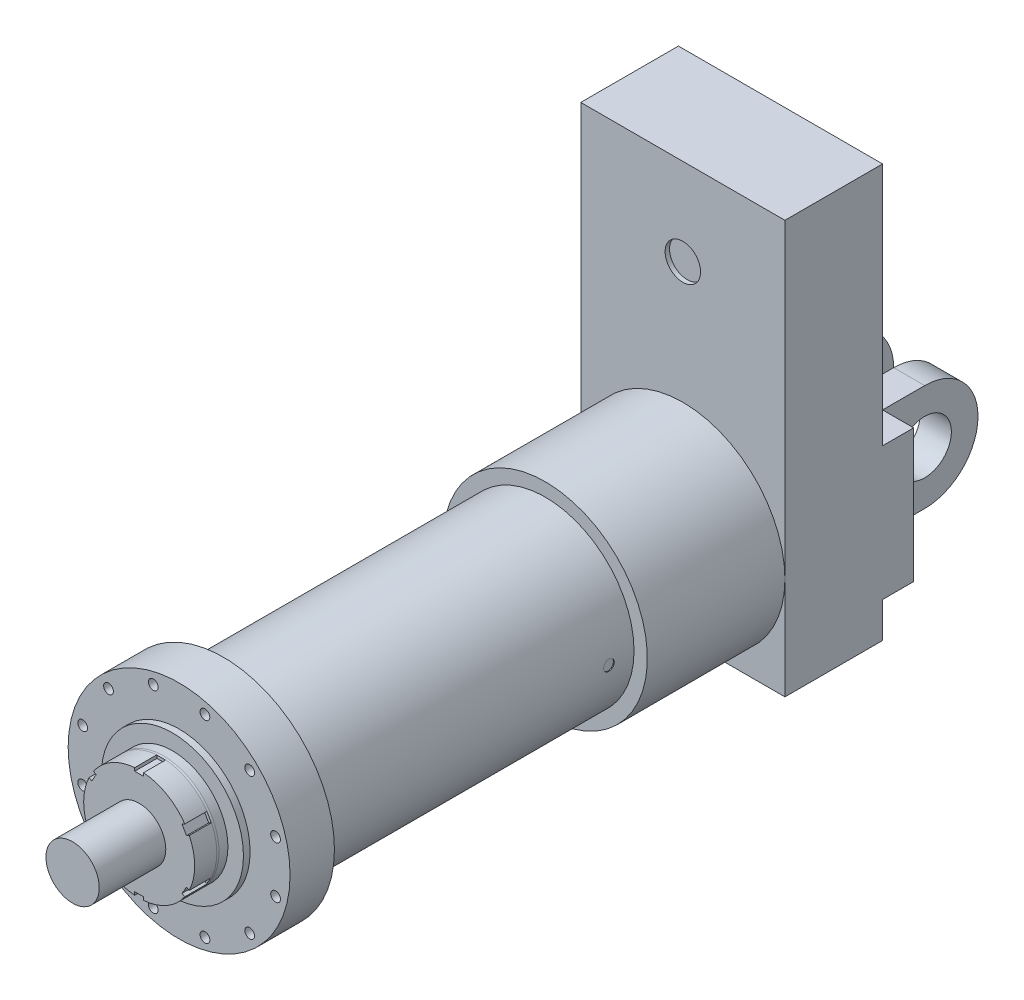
SolidWorks part; units mm, degrees
ref_plane "前视基准面" through (0, 0, 0) normal (0, 0, 1) x (1, 0, 0)
ref_plane "上视基准面" through (0, 0, 0) normal (0, 1, 0) x (1, 0, 0)
ref_plane "右视基准面" through (0, 0, 0) normal (1, 0, 0) x (0, 0, -1)
sketch "草图1" plane through (0, 0, 0) normal (0, 0, 1) x (1, 0, 0)
  circle A0 centre (0, 0) radius 200
  dimension "D1" = 400
extrude "凸台-拉伸1" add sketch "草图1" along normal blind 725
sketch "草图2" plane through (0, 0, 725) normal (0, 0, 1) x (1, 0, 0)
  line L0 (0, 0) -> (351.3656, 0) construction
  line L1 (0, 0) -> (299.4379, 80.2342) construction
  circle A0 centre (0, 0) radius 250
  circle A1 centre (0, 0) radius 225 construction
  circle A2 centre (217.3333, 58.2343) radius 11
  circle A3 centre (217.3333, -58.2343) radius 11
  circle A4 centre (159.099, -159.099) radius 11
  circle A5 centre (58.2343, -217.3333) radius 11
  circle A6 centre (-58.2343, -217.3333) radius 11
  circle A7 centre (-159.099, -159.099) radius 11
  circle A8 centre (-217.3333, -58.2343) radius 11
  circle A9 centre (-217.3333, 58.2343) radius 11
  circle A10 centre (-159.099, 159.099) radius 11
  circle A11 centre (-58.2343, 217.3333) radius 11
  circle A12 centre (58.2343, 217.3333) radius 11
  circle A13 centre (159.099, 159.099) radius 11
  point P32 (0, 0)
  dimension "D1" = 500
  dimension "D2" = 450
  dimension "D4" = 22
  dimension "D3" = 15
  dimension "D5" = 12
extrude "凸台-拉伸2" add sketch "草图2" along normal blind 100
sketch "草图3" plane through (0, 0, 825) normal (0, 0, 1) x (1, 0, 0)
  circle A0 centre (0, 0) radius 160
  dimension "D1" = 320
extrude "凸台-拉伸3" add sketch "草图3" along normal blind 15
sketch "草图4" plane through (0, 0, 840) normal (0, 0, 1) x (1, 0, 0)
  circle A1 centre (0, 0) radius 125
  dimension "D1" = 250
extrude "凸台-拉伸4" add sketch "草图4" along normal blind 25
chamfer "倒角1" distance 5 angle 10 1 edges at (125, 0, 865)
sketch "草图5" plane through (0, 0, 865) normal (0, 0, 1) x (1, 0, 0)
  line L0 (-10, 124.5994) -> (-10, 117.5)
  line L1 (-10, 117.5) -> (10, 117.5)
  line L2 (10, 117.5) -> (10, 124.5994)
  line L3 (102.9062, 70.9599) -> (96.758, 67.4103)
  line L4 (96.758, 67.4103) -> (106.758, 50.0897)
  line L5 (106.758, 50.0897) -> (112.9062, 53.6394)
  line L6 (112.9062, -53.6394) -> (106.758, -50.0897)
  line L7 (106.758, -50.0897) -> (96.758, -67.4103)
  line L8 (96.758, -67.4103) -> (102.9062, -70.9599)
  line L9 (10, -124.5994) -> (10, -117.5)
  line L10 (10, -117.5) -> (-10, -117.5)
  line L11 (-10, -117.5) -> (-10, -124.5994)
  line L12 (-102.9062, -70.9599) -> (-96.758, -67.4103)
  line L13 (-96.758, -67.4103) -> (-106.758, -50.0897)
  line L14 (-106.758, -50.0897) -> (-112.9062, -53.6394)
  line L15 (-112.9062, 53.6394) -> (-106.758, 50.0897)
  line L16 (-106.758, 50.0897) -> (-96.758, 67.4103)
  line L17 (-96.758, 67.4103) -> (-102.9062, 70.9599)
  arc A0 (-10, 124.5994) -> (-102.9062, 70.9599) centre (0, 0) ccw
  arc A1 (-112.9062, 53.6394) -> (-112.9062, -53.6394) centre (0, 0) ccw
  arc A2 (-102.9062, -70.9599) -> (-10, -124.5994) centre (0, 0) ccw
  arc A3 (10, -124.5994) -> (102.9062, -70.9599) centre (0, 0) ccw
  arc A4 (112.9062, -53.6394) -> (112.9062, 53.6394) centre (0, 0) ccw
  arc A5 (102.9062, 70.9599) -> (10, 124.5994) centre (0, 0) ccw
  point P28 (0, 0)
  dimension "D1" = 250
  dimension "D2" = 20
  dimension "D3" = 10
  dimension "D4" = 117.5
  dimension "D5" = 6
sketch "草图6" plane through (0, 0, 0) normal (0, 0, -1) x (-1, 0, 0)
  circle A0 centre (0, 0) radius 230
  dimension "D1" = 460
extrude "凸台-拉伸6" add sketch "草图6" along normal blind 310
ref_plane "基准面1" through (-200, 0, 0) normal (1, 0, 0) x (0, 0, -1)
sketch "草图9" plane through (-200, 0, 0) normal (1, 0, 0) x (0, 0, -1)
  line L0 (-725, -200) -> (-725, 200) construction
  circle A0 centre (-36.5, 0) radius 12
  circle A1 centre (-670.5, 0) radius 12
  dimension "D1" = 24
  dimension "D2" = 24
  dimension "D3" = 36.5
  dimension "D4" = 54.5
extrude "切除-拉伸2" cut sketch "草图9" along normal blind 2
ref_plane "基准面2" through (200, 0, 0) normal (1, 0, 0) x (0, 0, -1)
sketch "草图10" plane through (200, 0, 0) normal (1, 0, 0) x (0, 0, -1)
  circle A0 centre (-56.5, 0) radius 12
  dimension "D1" = 56.5
  dimension "D2" = 24
extrude "切除-拉伸3" cut sketch "草图10" against normal blind 2
extrude "凸台-拉伸7" add sketch "草图5" along normal blind 50
sketch "草图11" plane through (0, 0, 915) normal (0, 0, 1) x (1, 0, 0)
  circle A0 centre (0, 0) radius 60
  dimension "D1" = 120
extrude "凸台-拉伸8" add sketch "草图11" along normal blind 150
sketch "草图12" plane through (0, 0, -310) normal (0, 0, -1) x (-1, 0, 0)
  line L1 (-230, 700) -> (230, 700)
  line L2 (-230, 700) -> (-230, -230)
  line L3 (-230, -230) -> (230, -230)
  line L4 (230, 700) -> (230, -230)
  line L5 (-230, 700) -> (230, -230) construction
  line L6 (-230, -230) -> (230, 700) construction
  point P0 (0, 235)
  dimension "D1" = 460
  dimension "D2" = 930
  dimension "D3" = 230
extrude "凸台-拉伸9" add sketch "草图12" along normal blind 220
sketch "草图13" plane through (0, 0, -310) normal (0, 0, 1) x (1, 0, 0)
  line L0 (-230, 700) -> (230, 700) construction
  circle A0 centre (0, 504) radius 40
  dimension "D1" = 80
  dimension "D2" = 196
extrude "切除-拉伸4" cut sketch "草图13" against normal blind 10 contours A0
sketch "草图14" plane through (0, 0, -530) normal (0, 0, -1) x (-1, 0, 0)
  line L0 (230, -230) -> (230, 700) construction
  line L1 (-230, 150) -> (230, 150)
  line L2 (-230, 150) -> (-230, -150)
  line L3 (-230, -150) -> (230, -150)
  line L4 (230, 150) -> (230, -150)
  line L5 (-230, 150) -> (230, -150) construction
  line L6 (-230, -150) -> (230, 150) construction
  point P0 (0, 0)
  dimension "D1" = 300
extrude "凸台-拉伸10" add sketch "草图14" along normal blind 70
sketch "草图15" plane through (0, 0, -600) normal (0, 0, -1) x (-1, 0, 0)
  line L0 (-95, 0) -> (95, 0) construction
  line L2 (-130, 120) -> (-60, 120)
  line L3 (-130, 120) -> (-130, -120)
  line L4 (-130, -120) -> (-60, -120)
  line L5 (-60, 120) -> (-60, -120)
  line L6 (-130, 120) -> (-60, -120) construction
  line L7 (-130, -120) -> (-60, 120) construction
  line L8 (60, 120) -> (130, 120)
  line L9 (60, 120) -> (60, -120)
  line L10 (60, -120) -> (130, -120)
  line L11 (130, 120) -> (130, -120)
  line L12 (60, 120) -> (130, -120) construction
  line L13 (60, -120) -> (130, 120) construction
  point P4 (0, 0)
  dimension "D1" = 260
  dimension "D2" = 120
  dimension "D3" = 70
  dimension "D4" = 240
  dimension "D5" = 240
extrude "凸台-拉伸11" add sketch "草图15" along normal blind 245
sketch "草图16" plane through (-130, 0, 0) normal (-1, 0, 0) x (0, 0, 1)
  line L0 (-845, 0) -> (-725, 0) construction
  line L1 (-845, -120) -> (-845, 120) construction
  line L2 (-725, 120) -> (-1030.4859, 228.3933)
  line L3 (-1030.4859, 228.3933) -> (-999.7897, -216.2366)
  line L4 (-999.7897, -216.2366) -> (-725, -120)
  arc A0 (-725, 120) -> (-725, -120) centre (-725, 0) ccw
  circle A1 centre (-725, 0) radius 60
  dimension "D1" = 120
  dimension "D2" = 120
extrude "切除-拉伸5" cut sketch "草图16" against normal blind 297
chamfer "倒角2" distance 20 angle 45 8 edges at (130, 0, -600) (95, -120, -600) (60, 0, -600) (95, 120, -600) (-60, 0, -600) (-95, -120, -600) (-130, 0, -600) (-95, 120, -600)
